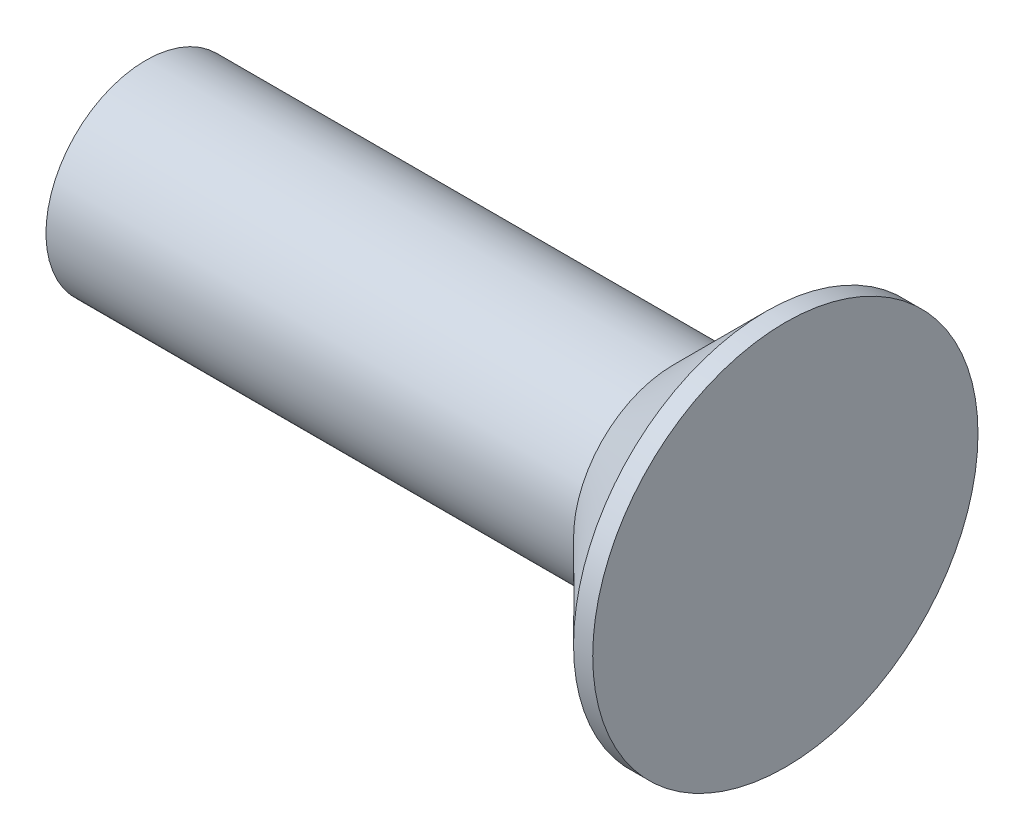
SolidWorks part; units mm, degrees
ref_plane "Alzado" through (0, 0, 0) normal (0, 0, 1) x (1, 0, 0)
ref_plane "Planta" through (0, 0, 0) normal (0, 1, 0) x (1, 0, 0)
ref_plane "Vista lateral" through (0, 0, 0) normal (1, 0, 0) x (0, 0, -1)
ref_plane "Plano1" through (0, 0, -252.5) normal (0, 0, 1) x (1, 0, 0)
sketch "Croquis1" plane through (0, 0, -252.5) normal (0, 0, 1) x (1, 0, 0)
  line L0 (-9.9, -3) -> (-9.9, -5.5)
  line L1 (-9.9, -5.5) -> (6.1, -5.5)
  line L2 (6.1, -5.5) -> (6.1, -0.68)
  line L3 (6.1, -0.68) -> (5.62, -0.68)
  line L4 (5.62, -0.68) -> (3.3, -3)
  line L5 (3.3, -3) -> (-9.9, -3)
  line L6 (-9.9, -5.5) -> (6.1, -5.5) construction
revolve "Revolución1" add sketch "Croquis1" angle 360 about L6
